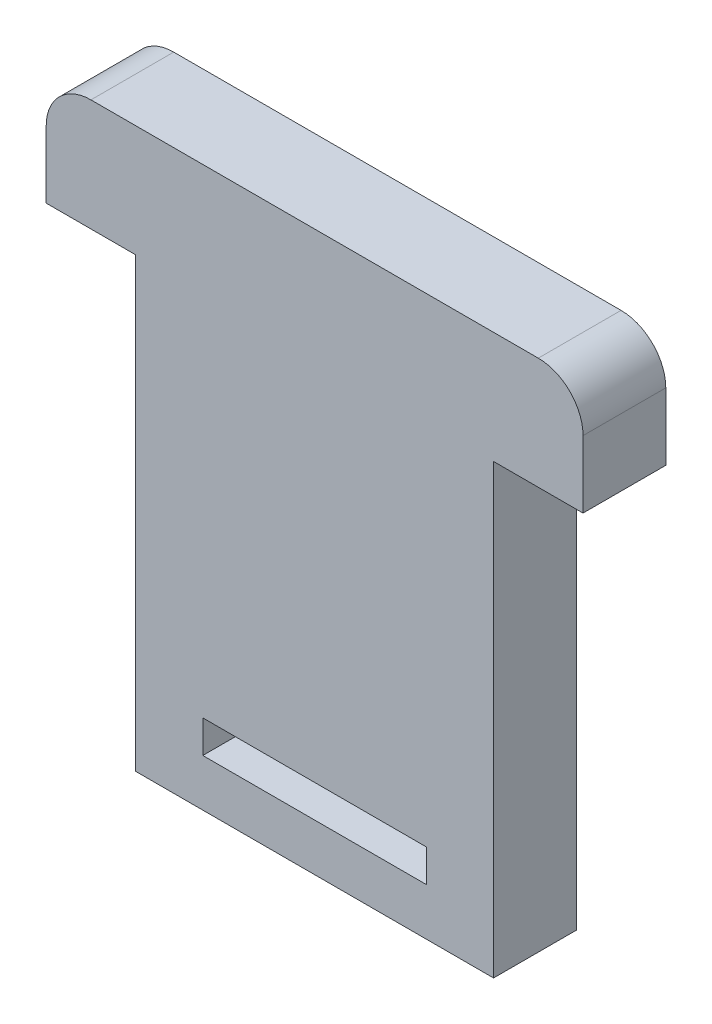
SolidWorks part; units mm, degrees
ref_plane "Front Plane" through (0, 0, 0) normal (0, 0, 1) x (1, 0, 0)
ref_plane "Top Plane" through (0, 0, 0) normal (0, 1, 0) x (1, 0, 0)
ref_plane "Right Plane" through (0, 0, 0) normal (1, 0, 0) x (0, 0, -1)
sketch "Sketch1" plane through (0, 0, 0) normal (0, 0, 1) x (1, 0, 0)
  line L1 (-10.16, 12.7) -> (10.16, 12.7)
  line L2 (-10.16, 12.7) -> (-10.16, -12.7)
  line L3 (-10.16, -12.7) -> (10.16, -12.7)
  line L4 (10.16, 12.7) -> (10.16, -12.7)
  line L5 (-10.16, 12.7) -> (10.16, -12.7) construction
  line L6 (-10.16, -12.7) -> (10.16, 12.7) construction
  line L7 (-15.24, 19.05) -> (15.24, 19.05)
  line L8 (-15.24, 19.05) -> (-15.24, 12.7)
  line L9 (-15.24, 12.7) -> (15.24, 12.7)
  line L10 (15.24, 19.05) -> (15.24, 12.7)
  line L11 (-15.24, 19.05) -> (15.24, 12.7) construction
  line L12 (-15.24, 12.7) -> (15.24, 19.05) construction
  point P0 (0, 0)
  point P6 (0, 15.875)
  dimension "D1" = 20.32
  dimension "D2" = 6.35
  dimension "D3" = 5.08
  dimension "D4" = 31.75
sketch "Sketch2" plane through (0, 0, 0) normal (0, 0, 1) x (1, 0, 0)
  line L0 (10.16, 12.7) -> (15.24, 12.7)
  line L4 (15.24, 19.05) -> (-15.24, 19.05)
  line L5 (15.24, 12.7) -> (15.24, 19.05)
  line L6 (-15.24, 12.7) -> (15.24, 12.7)
  line L7 (-15.24, 19.05) -> (-15.24, 12.7)
  line L8 (15.24, 19.05) -> (-15.24, 19.05)
  line L9 (15.24, 12.7) -> (15.24, 19.05)
  line L10 (-15.24, 12.7) -> (-10.16, 12.7)
  line L11 (-15.24, 19.05) -> (-15.24, 12.7)
  line L12 (10.16, 12.7) -> (-10.16, 12.7)
  line L13 (10.16, -12.7) -> (10.16, 12.7)
  line L14 (-10.16, -12.7) -> (10.16, -12.7)
  line L15 (-10.16, 12.7) -> (-10.16, -12.7)
  line L17 (10.16, -12.7) -> (10.16, 12.7)
  line L18 (-10.16, -12.7) -> (10.16, -12.7)
  line L19 (-10.16, 12.7) -> (-10.16, -12.7)
  dimension "D1" = 0
  dimension "D2" = 0
extrude "Boss-Extrude1" add sketch "Sketch2" along normal mid plane 4.699
sketch "Sketch3" plane through (0, 0, -2.3495) normal (0, 0, -1) x (-1, 0, 0)
  line L4 (-6.35, -10.013) -> (6.35, -10.013)
  line L5 (-6.35, -8.163) -> (-6.35, -10.013)
  line L6 (6.35, -8.163) -> (-6.35, -8.163)
  line L7 (6.35, -10.013) -> (6.35, -8.163)
  line L8 (-6.35, -10.013) -> (6.35, -10.013)
  line L9 (-6.35, -8.163) -> (-6.35, -10.013)
  line L10 (6.35, -8.163) -> (-6.35, -8.163)
  line L11 (6.35, -10.013) -> (6.35, -8.163)
  dimension "D1" = 0
extrude "Cut-Extrude1" cut sketch "Sketch3" against normal through all
fillet "Fillet1" [suppressed] radius 6.35
fillet "Fillet2" radius 2.54 2 edges at (15.24, 19.05, 0) (-15.24, 19.05, 0)
